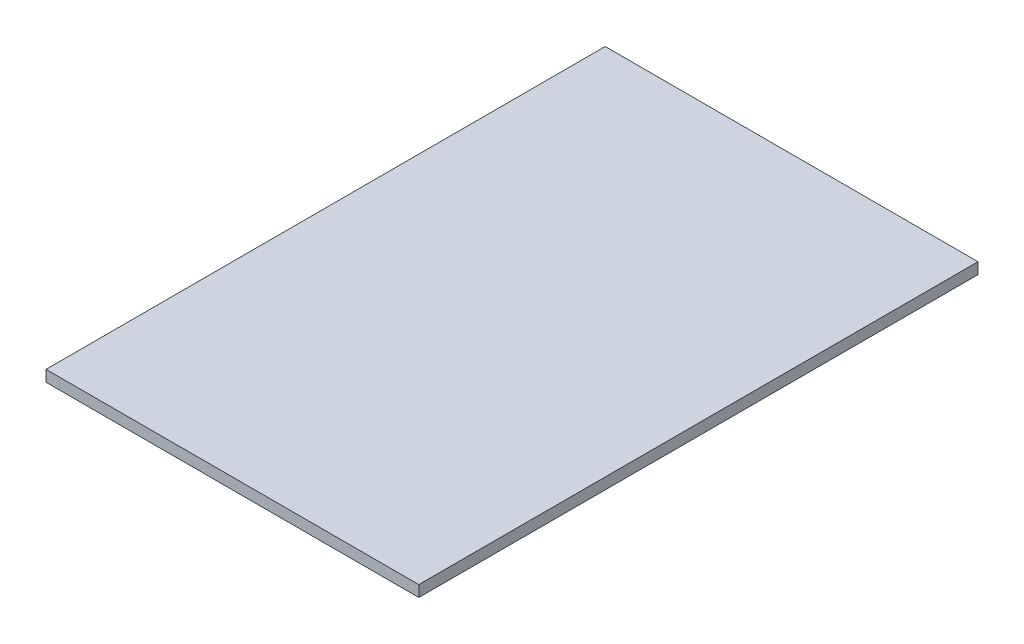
SolidWorks part; units mm, degrees
ref_plane "Plan de face" through (0, 0, 0) normal (0, 0, 1) x (1, 0, 0)
ref_plane "Plan de dessus" through (0, 0, 0) normal (0, 1, 0) x (1, 0, 0)
ref_plane "Plan de droite" through (0, 0, 0) normal (1, 0, 0) x (0, 0, -1)
sketch "Esquisse1" plane through (0, 0, 0) normal (0, 1, 0) x (1, 0, 0)
  line L1 (-50, 75) -> (50, 75)
  line L2 (-50, 75) -> (-50, -75)
  line L3 (-50, -75) -> (50, -75)
  line L4 (50, 75) -> (50, -75)
  line L5 (-50, 75) -> (50, -75) construction
  line L6 (-50, -75) -> (50, 75) construction
  point P0 (0, 0)
  dimension "D1" = 150
  dimension "D2" = 100
extrude "Boss.-Extru.1" add sketch "Esquisse1" along normal blind 3
